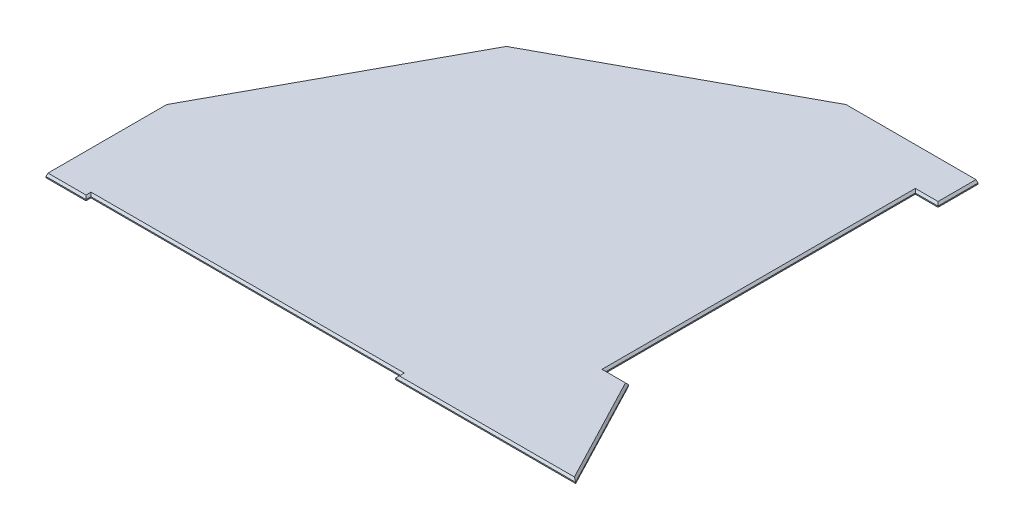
SolidWorks part; units mm, degrees
ref_plane "Front Plane" through (0, 0, 0) normal (1, 0, 0) x (0, 1, 0)
ref_plane "Top Plane" through (0, 0, 0) normal (0, 0, 1) x (0, 1, 0)
ref_plane "Right Plane" through (0, 0, 0) normal (0, 1, 0) x (-1, 0, 0)
sketch "Sketch2" plane through (0, 0, 0) normal (0, 1, 0) x (-1, 0, 0)
  line B0 (604.7159, 547.7126) -> (604.7159, 560.2376)
  line B1 (-418.4966, -491.5527) -> (-475.2966, -491.5527)
  line B2 (604.7159, 547.7126) -> (-169.2841, 547.7126)
  line B3 (-169.2841, 547.7126) -> (-169.2841, 560.2376)
  line B4 (-620.4841, 560.2376) -> (-169.2841, 560.2376)
  line B5 (-620.4841, 560.2376) -> (-475.2966, 282.4473)
  line B6 (-418.4966, 282.4473) -> (-475.2966, 282.4473)
  line B7 (-418.4966, 282.4473) -> (-418.4966, -491.5527)
  line B8 (-475.2966, -491.5527) -> (-475.2966, -591.5527)
  line B9 (-475.2966, -591.5527) -> (-145.1683, -591.5527)
  line B10 (-145.1683, -591.5527) -> (405.7448, -292.5815)
  line B11 (405.7448, -292.5815) -> (704.7159, 258.3315)
  line B12 (704.7159, 560.2376) -> (704.7159, 258.3315)
  line B13 (604.7159, 560.2376) -> (704.7159, 560.2376)
sketch_block_instance "Block3-1"
sketch_block "Block3" parameters "D1"=6, "D2"=6, "D3"=6
extrude "Boss-Extrude2" add sketch "Sketch2" along normal mid plane 12.7
chamfer "Chamfer1" distance 5 angle 45 20 edges at (-654.7159, -6.35, 560.2376) (-604.7159, -6.35, 553.9751) (-217.7159, -6.35, 547.7126) (169.2841, -6.35, 553.9751) (394.8841, -6.35, 560.2376) (475.2966, -6.35, -541.5527) (446.8966, -6.35, -491.5527) (418.4966, -6.35, -104.5527) (446.8966, -6.35, 282.4473) (547.8903, -6.35, 421.3425) (-654.7159, 6.35, 560.2376) (-604.7159, 6.35, 553.9751) (-217.7159, 6.35, 547.7126) (169.2841, 6.35, 553.9751) (394.8841, 6.35, 560.2376) (475.2966, 6.35, -541.5527) (446.8966, 6.35, -491.5527) (418.4966, 6.35, -104.5527) (446.8966, 6.35, 282.4473) (547.8903, 6.35, 421.3425)
